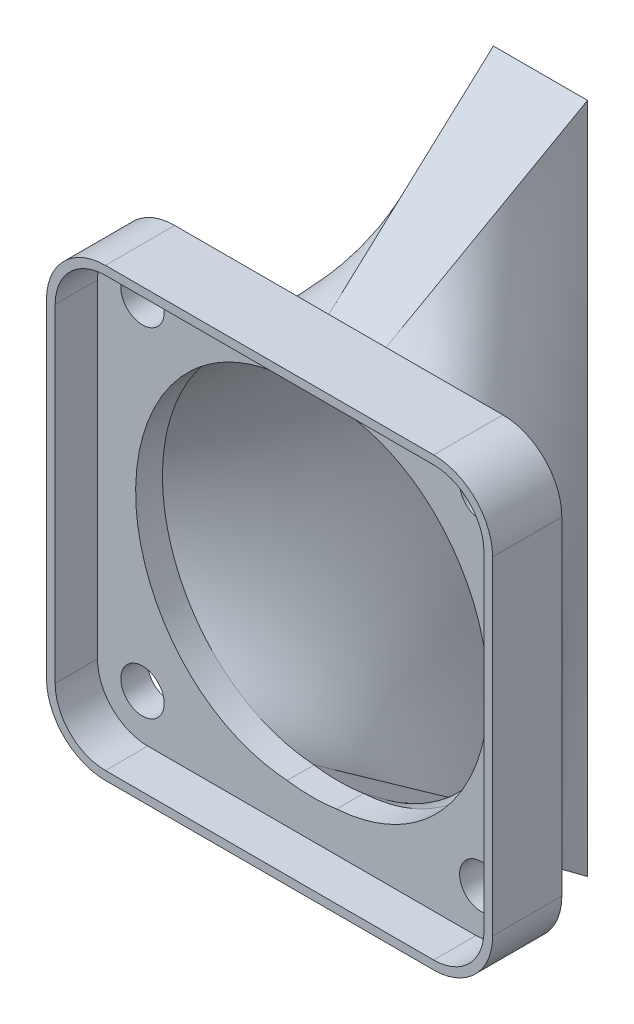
SolidWorks part; units mm, degrees
ref_plane "Front Plane" through (0, 0, 0) normal (0, 0, 1) x (1, 0, 0)
ref_plane "Top Plane" through (0, 0, 0) normal (0, 1, 0) x (1, 0, 0)
ref_plane "Right Plane" through (0, 0, 0) normal (1, 0, 0) x (0, 0, -1)
sketch "Sketch1" plane through (0, 0, 0) normal (0, 0, 1) x (1, 0, 0)
  line L8 (556.6783, -1295.6386) -> (566.1039, -1295.6386)
  line L9 (541.7911, -1271.3258) -> (541.7911, -1280.7514)
  line L10 (566.1039, -1256.4386) -> (556.6783, -1256.4386)
  line L11 (580.9911, -1280.7514) -> (580.9911, -1271.3258)
  line L18 (578.1165, -1263.5558) -> (577.608, -1264.0644)
  line L19 (580.1823, -1267.0666) -> (579.5228, -1267.2289)
  line L28 (581.1911, -1266.0843) -> (580.7911, -1266.0843)
  line L29 (580.7911, -1266.0843) -> (580.7911, -1266.2898)
  line L30 (578.1165, -1263.5558) -> (579.4254, -1262.247)
  line L31 (580.7911, -1262.8126) -> (580.7911, -1263.493)
  line L32 (580.7911, -1263.493) -> (581.1911, -1263.493)
  line L33 (581.1911, -1263.493) -> (581.1911, -1260.5386)
  line L34 (576.8911, -1256.2386) -> (545.8911, -1256.2386)
  line L35 (541.5911, -1260.5386) -> (541.5911, -1291.5386)
  line L36 (545.8911, -1295.8386) -> (576.8911, -1295.8386)
  line L37 (581.1911, -1291.5386) -> (581.1911, -1266.0843)
  arc A4 (547.4411, -1260.0386) -> (543.3411, -1260.0386) centre (545.3911, -1260.0386) ccw
  arc A5 (543.3411, -1260.0386) -> (547.4411, -1260.0386) centre (545.3911, -1260.0386) ccw
  arc A8 (579.4411, -1292.0386) -> (575.3411, -1292.0386) centre (577.3911, -1292.0386) ccw
  arc A9 (575.3411, -1292.0386) -> (579.4411, -1292.0386) centre (577.3911, -1292.0386) ccw
  arc A12 (547.4411, -1292.0386) -> (543.3411, -1292.0386) centre (545.3911, -1292.0386) ccw
  arc A13 (543.3411, -1292.0386) -> (547.4411, -1292.0386) centre (545.3911, -1292.0386) ccw
  arc A28 (579.4411, -1260.0386) -> (575.3411, -1260.0386) centre (577.3911, -1260.0386) ccw
  arc A29 (575.3411, -1260.0386) -> (579.4411, -1260.0386) centre (577.3911, -1260.0386) ccw
  arc A36 (576.8802, -1288.9405) -> (580.9911, -1280.7514) centre (561.3911, -1276.0386) ccw
  arc A37 (576.8802, -1288.9405) -> (574.2929, -1291.5278) centre (577.3911, -1292.0386) ccw
  arc A38 (566.1039, -1295.6386) -> (574.2929, -1291.5278) centre (561.3911, -1276.0386) ccw
  arc A39 (548.4892, -1291.5278) -> (556.6783, -1295.6386) centre (561.3911, -1276.0386) ccw
  arc A40 (548.4892, -1291.5278) -> (545.902, -1288.9405) centre (545.3911, -1292.0386) ccw
  arc A41 (541.7911, -1280.7514) -> (545.902, -1288.9405) centre (561.3911, -1276.0386) ccw
  arc A42 (545.902, -1263.1368) -> (541.7911, -1271.3258) centre (561.3911, -1276.0386) ccw
  arc A43 (545.902, -1263.1368) -> (548.4892, -1260.5495) centre (545.3911, -1260.0386) ccw
  arc A44 (556.6783, -1256.4386) -> (548.4892, -1260.5495) centre (561.3911, -1276.0386) ccw
  arc A45 (574.2929, -1260.5495) -> (566.1039, -1256.4386) centre (561.3911, -1276.0386) ccw
  arc A46 (574.2929, -1260.5495) -> (576.8802, -1263.1368) centre (577.3911, -1260.0386) ccw
  arc A47 (580.9911, -1271.3258) -> (579.5228, -1267.2289) centre (561.3911, -1276.0386) ccw
  arc A49 (577.608, -1264.0644) -> (576.8802, -1263.1368) centre (561.3911, -1276.0386) ccw
  arc A58 (580.1823, -1267.0666) -> (580.7911, -1266.2898) centre (579.9911, -1266.2898) ccw
  arc A62 (580.7911, -1262.8126) -> (579.4254, -1262.247) centre (579.9911, -1262.8126) ccw
  arc A63 (581.1911, -1260.5386) -> (576.8911, -1256.2386) centre (576.8911, -1260.5386) ccw
  arc A64 (545.8911, -1256.2386) -> (541.5911, -1260.5386) centre (545.8911, -1260.5386) ccw
  arc A65 (541.5911, -1291.5386) -> (545.8911, -1295.8386) centre (545.8911, -1291.5386) ccw
  arc A66 (576.8911, -1295.8386) -> (581.1911, -1291.5386) centre (576.8911, -1291.5386) ccw
extrude "Boss-Extrude1" add sketch "Sketch1" along normal blind 2.54
sketch "Sketch2" plane through (0, 0, 2.54) normal (0, 0, 1) x (1, 0, 0)
  line L0 (582.4611, -1291.5386) -> (582.4611, -1264.8143)
  line L1 (582.4611, -1264.8143) -> (579.5211, -1264.8143)
  line L2 (579.5211, -1264.8143) -> (579.5211, -1265.9215)
  line L3 (579.5211, -1265.9215) -> (577.628, -1266.3875)
  line L4 (579.7211, -1271.4788) -> (579.7211, -1280.5984)
  line L5 (565.9509, -1294.3686) -> (556.8313, -1294.3686)
  line L6 (543.0611, -1280.5984) -> (543.0611, -1271.4788)
  line L7 (556.8313, -1257.7086) -> (565.9509, -1257.7086)
  line L8 (577.421, -1266.0474) -> (579.5211, -1263.9473)
  line L9 (579.5211, -1263.9473) -> (579.5211, -1264.763)
  line L10 (579.5211, -1264.763) -> (582.4611, -1264.763)
  line L11 (582.4611, -1264.763) -> (582.4611, -1260.5386)
  line L12 (576.8911, -1254.9686) -> (545.8911, -1254.9686)
  line L13 (540.3211, -1260.5386) -> (540.3211, -1291.5386)
  line L14 (545.8911, -1297.1086) -> (576.8911, -1297.1086)
  line L15 (581.1911, -1291.5386) -> (581.1911, -1266.0843)
  line L16 (581.1911, -1266.0843) -> (580.7911, -1266.0843)
  line L17 (580.7911, -1266.0843) -> (580.7911, -1266.2898)
  line L18 (580.1823, -1267.0666) -> (579.5228, -1267.2289)
  line L19 (580.9911, -1271.3258) -> (580.9911, -1280.7514)
  line L20 (566.1039, -1295.6386) -> (556.6783, -1295.6386)
  line L21 (541.7911, -1280.7514) -> (541.7911, -1271.3258)
  line L22 (556.6783, -1256.4386) -> (566.1039, -1256.4386)
  line L23 (577.608, -1264.0644) -> (579.4254, -1262.247)
  line L24 (580.7911, -1262.8126) -> (580.7911, -1263.493)
  line L25 (580.7911, -1263.493) -> (581.1911, -1263.493)
  line L26 (581.1911, -1263.493) -> (581.1911, -1260.5386)
  line L27 (576.8911, -1256.2386) -> (545.8911, -1256.2386)
  line L28 (541.5911, -1260.5386) -> (541.5911, -1291.5386)
  line L29 (545.8911, -1295.8386) -> (576.8911, -1295.8386)
  line L30 (581.1911, -1291.5386) -> (581.1911, -1266.0843)
  line L31 (581.1911, -1266.0843) -> (580.7911, -1266.0843)
  line L32 (580.7911, -1266.0843) -> (580.7911, -1266.2898)
  line L33 (580.1823, -1267.0666) -> (579.5228, -1267.2289)
  line L34 (580.9911, -1271.3258) -> (580.9911, -1280.7514)
  line L35 (566.1039, -1295.6386) -> (556.6783, -1295.6386)
  line L36 (541.7911, -1280.7514) -> (541.7911, -1271.3258)
  line L37 (556.6783, -1256.4386) -> (566.1039, -1256.4386)
  line L38 (577.608, -1264.0644) -> (579.4254, -1262.247)
  line L39 (580.7911, -1262.8126) -> (580.7911, -1263.493)
  line L40 (580.7911, -1263.493) -> (581.1911, -1263.493)
  line L41 (581.1911, -1263.493) -> (581.1911, -1260.5386)
  line L42 (576.8911, -1256.2386) -> (545.8911, -1256.2386)
  line L43 (541.5911, -1260.5386) -> (541.5911, -1291.5386)
  line L44 (545.8911, -1295.8386) -> (576.8911, -1295.8386)
  line L45 (581.1911, -1266.0843) -> (582.4611, -1266.0843)
  line L46 (581.1911, -1263.493) -> (582.4611, -1263.493)
  arc A0 (579.5211, -1265.9215) -> (579.5211, -1265.9215) centre (579.5211, -1265.9215) ccw
  arc A1 (579.7211, -1271.4788) -> (577.628, -1266.3875) centre (561.3911, -1276.0386) ccw
  arc A2 (576.1704, -1287.8009) -> (579.7211, -1280.5984) centre (561.3911, -1276.0386) ccw
  arc A3 (576.1704, -1287.8009) -> (573.1534, -1290.818) centre (577.3911, -1292.0386) ccw
  arc A4 (565.9509, -1294.3686) -> (573.1534, -1290.818) centre (561.3911, -1276.0386) ccw
  arc A5 (549.6288, -1290.818) -> (556.8313, -1294.3686) centre (561.3911, -1276.0386) ccw
  arc A6 (549.6288, -1290.818) -> (546.6117, -1287.8009) centre (545.3911, -1292.0386) ccw
  arc A7 (543.0611, -1280.5984) -> (546.6117, -1287.8009) centre (561.3911, -1276.0386) ccw
  arc A8 (546.6117, -1264.2763) -> (543.0611, -1271.4788) centre (561.3911, -1276.0386) ccw
  arc A9 (546.6117, -1264.2763) -> (549.6288, -1261.2593) centre (545.3911, -1260.0386) ccw
  arc A10 (556.8313, -1257.7086) -> (549.6288, -1261.2593) centre (561.3911, -1276.0386) ccw
  arc A11 (573.1534, -1261.2593) -> (565.9509, -1257.7086) centre (561.3911, -1276.0386) ccw
  arc A12 (573.1534, -1261.2593) -> (576.1704, -1264.2763) centre (577.3911, -1260.0386) ccw
  arc A13 (577.421, -1266.0474) -> (576.1704, -1264.2763) centre (561.3911, -1276.0386) ccw
  arc A14 (579.5211, -1263.9473) -> (579.5211, -1263.9473) centre (579.5211, -1263.9473) ccw
  arc A15 (582.4611, -1260.5386) -> (576.8911, -1254.9686) centre (576.8911, -1260.5386) ccw
  arc A16 (545.8911, -1254.9686) -> (540.3211, -1260.5386) centre (545.8911, -1260.5386) ccw
  arc A17 (540.3211, -1291.5386) -> (545.8911, -1297.1086) centre (545.8911, -1291.5386) ccw
  arc A18 (576.8911, -1297.1086) -> (582.4611, -1291.5386) centre (576.8911, -1291.5386) ccw
  arc A19 (580.1823, -1267.0666) -> (580.7911, -1266.2898) centre (579.9911, -1266.2898) ccw
  arc A20 (580.9911, -1271.3258) -> (579.5228, -1267.2289) centre (561.3911, -1276.0386) ccw
  arc A21 (576.8802, -1288.9405) -> (580.9911, -1280.7514) centre (561.3911, -1276.0386) ccw
  arc A22 (576.8802, -1288.9405) -> (574.2929, -1291.5278) centre (577.3911, -1292.0386) ccw
  arc A23 (566.1039, -1295.6386) -> (574.2929, -1291.5278) centre (561.3911, -1276.0386) ccw
  arc A24 (548.4892, -1291.5278) -> (556.6783, -1295.6386) centre (561.3911, -1276.0386) ccw
  arc A25 (548.4892, -1291.5278) -> (545.902, -1288.9405) centre (545.3911, -1292.0386) ccw
  arc A26 (541.7911, -1280.7514) -> (545.902, -1288.9405) centre (561.3911, -1276.0386) ccw
  arc A27 (545.902, -1263.1368) -> (541.7911, -1271.3258) centre (561.3911, -1276.0386) ccw
  arc A28 (545.902, -1263.1368) -> (548.4892, -1260.5495) centre (545.3911, -1260.0386) ccw
  arc A29 (556.6783, -1256.4386) -> (548.4892, -1260.5495) centre (561.3911, -1276.0386) ccw
  arc A30 (574.2929, -1260.5495) -> (566.1039, -1256.4386) centre (561.3911, -1276.0386) ccw
  arc A31 (574.2929, -1260.5495) -> (576.8802, -1263.1368) centre (577.3911, -1260.0386) ccw
  arc A32 (577.608, -1264.0644) -> (576.8802, -1263.1368) centre (561.3911, -1276.0386) ccw
  arc A33 (580.7911, -1262.8126) -> (579.4254, -1262.247) centre (579.9911, -1262.8126) ccw
  arc A34 (581.1911, -1260.5386) -> (576.8911, -1256.2386) centre (576.8911, -1260.5386) ccw
  arc A35 (545.8911, -1256.2386) -> (541.5911, -1260.5386) centre (545.8911, -1260.5386) ccw
  arc A36 (541.5911, -1291.5386) -> (545.8911, -1295.8386) centre (545.8911, -1291.5386) ccw
  arc A37 (576.8911, -1295.8386) -> (581.1911, -1291.5386) centre (576.8911, -1291.5386) ccw
  arc A38 (580.1823, -1267.0666) -> (580.7911, -1266.2898) centre (579.9911, -1266.2898) ccw
  arc A39 (580.9911, -1271.3258) -> (579.5228, -1267.2289) centre (561.3911, -1276.0386) ccw
  arc A40 (576.8802, -1288.9405) -> (580.9911, -1280.7514) centre (561.3911, -1276.0386) ccw
  arc A41 (576.8802, -1288.9405) -> (574.2929, -1291.5278) centre (577.3911, -1292.0386) ccw
  arc A42 (566.1039, -1295.6386) -> (574.2929, -1291.5278) centre (561.3911, -1276.0386) ccw
  arc A43 (548.4892, -1291.5278) -> (556.6783, -1295.6386) centre (561.3911, -1276.0386) ccw
  arc A44 (548.4892, -1291.5278) -> (545.902, -1288.9405) centre (545.3911, -1292.0386) ccw
  arc A45 (541.7911, -1280.7514) -> (545.902, -1288.9405) centre (561.3911, -1276.0386) ccw
  arc A46 (545.902, -1263.1368) -> (541.7911, -1271.3258) centre (561.3911, -1276.0386) ccw
  arc A47 (545.902, -1263.1368) -> (548.4892, -1260.5495) centre (545.3911, -1260.0386) ccw
  arc A48 (556.6783, -1256.4386) -> (548.4892, -1260.5495) centre (561.3911, -1276.0386) ccw
  arc A49 (574.2929, -1260.5495) -> (566.1039, -1256.4386) centre (561.3911, -1276.0386) ccw
  arc A50 (574.2929, -1260.5495) -> (576.8802, -1263.1368) centre (577.3911, -1260.0386) ccw
  arc A51 (577.608, -1264.0644) -> (576.8802, -1263.1368) centre (561.3911, -1276.0386) ccw
  arc A52 (580.7911, -1262.8126) -> (579.4254, -1262.247) centre (579.9911, -1262.8126) ccw
  arc A53 (581.1911, -1260.5386) -> (576.8911, -1256.2386) centre (576.8911, -1260.5386) ccw
  arc A54 (545.8911, -1256.2386) -> (541.5911, -1260.5386) centre (545.8911, -1260.5386) ccw
  arc A55 (541.5911, -1291.5386) -> (545.8911, -1295.8386) centre (545.8911, -1291.5386) ccw
  arc A56 (576.8911, -1295.8386) -> (581.1911, -1291.5386) centre (576.8911, -1291.5386) ccw
  dimension "D1" = 0
  dimension "D2" = 1.27
extrude "Boss-Extrude2" add sketch "Sketch2" against normal up to vertex contours L14 A18 L0 L45 L46 L11 A15 L12 A16 L13 A17 M37 M70 M69 M68 M67 M66 M65 M64 M63
sketch "Sketch3" plane through (0, 0, 2.54) normal (0, 0, 1) x (1, 0, 0)
  line L0 (576.8911, -1291.5386) -> (574.2727, -1288.9203)
  line L15 (582.4611, -1291.5386) -> (582.4611, -1266.0843)
  line L16 (582.4611, -1266.0843) -> (580.7911, -1266.0843)
  line L17 (580.7911, -1266.0843) -> (580.7911, -1266.2898)
  line L18 (580.1823, -1267.0666) -> (579.5228, -1267.2289)
  line L19 (580.9911, -1271.3258) -> (580.9911, -1280.7514)
  line L20 (566.1039, -1295.6386) -> (556.6783, -1295.6386)
  line L21 (541.7911, -1280.7514) -> (541.7911, -1271.3258)
  line L22 (556.6783, -1256.4386) -> (566.1039, -1256.4386)
  line L23 (577.608, -1264.0644) -> (579.4254, -1262.247)
  line L24 (580.7911, -1262.8126) -> (580.7911, -1263.493)
  line L25 (580.7911, -1263.493) -> (582.4611, -1263.493)
  line L26 (582.4611, -1263.493) -> (582.4611, -1260.5386)
  line L27 (576.8911, -1254.9686) -> (545.8911, -1254.9686)
  line L28 (540.3211, -1260.5386) -> (540.3211, -1291.5386)
  line L29 (545.8911, -1297.1086) -> (576.8911, -1297.1086)
  line L30 (582.4611, -1291.5386) -> (582.4611, -1266.0843)
  line L31 (582.4611, -1266.0843) -> (580.7911, -1266.0843)
  line L32 (580.7911, -1266.0843) -> (580.7911, -1266.2898)
  line L33 (580.1823, -1267.0666) -> (579.5228, -1267.2289)
  line L34 (580.9911, -1271.3258) -> (580.9911, -1280.7514)
  line L35 (566.1039, -1295.6386) -> (556.6783, -1295.6386)
  line L36 (541.7911, -1280.7514) -> (541.7911, -1271.3258)
  line L37 (556.6783, -1256.4386) -> (566.1039, -1256.4386)
  line L38 (577.608, -1264.0644) -> (579.4254, -1262.247)
  line L39 (580.7911, -1262.8126) -> (580.7911, -1263.493)
  line L40 (580.7911, -1263.493) -> (582.4611, -1263.493)
  line L41 (582.4611, -1263.493) -> (582.4611, -1260.5386)
  line L42 (576.8911, -1254.9686) -> (545.8911, -1254.9686)
  line L43 (540.3211, -1260.5386) -> (540.3211, -1291.5386)
  line L44 (545.8911, -1297.1086) -> (576.8911, -1297.1086)
  arc A0 (574.2929, -1260.5495) -> (576.8802, -1263.1368) centre (577.3911, -1260.0386) ccw construction
  circle A1 centre (545.3911, -1260.0386) radius 2.05
  circle A2 centre (545.3911, -1260.0386) radius 2.05
  circle A3 centre (577.3911, -1292.0386) radius 2.05
  circle A4 centre (577.3911, -1292.0386) radius 2.05
  circle A5 centre (545.3911, -1292.0386) radius 2.05
  circle A6 centre (545.3911, -1292.0386) radius 2.05
  circle A7 centre (577.3911, -1260.0386) radius 2.05
  circle A8 centre (577.3911, -1260.0386) radius 2.05
  arc A9 (545.902, -1263.1368) -> (548.4892, -1260.5495) centre (545.3911, -1260.0386) ccw construction
  arc A10 (548.4892, -1291.5278) -> (545.902, -1288.9405) centre (545.3911, -1292.0386) ccw construction
  arc A11 (576.8802, -1288.9405) -> (574.2929, -1291.5278) centre (577.3911, -1292.0386) ccw construction
  arc A12 (574.2929, -1260.5495) -> (576.8802, -1263.1368) centre (577.3911, -1260.0386) ccw
  arc A13 (545.902, -1263.1368) -> (548.4892, -1260.5495) centre (545.3911, -1260.0386) ccw
  arc A14 (548.4892, -1291.5278) -> (545.902, -1288.9405) centre (545.3911, -1292.0386) ccw
  arc A15 (576.8802, -1288.9405) -> (574.2929, -1291.5278) centre (577.3911, -1292.0386) ccw
  arc A16 (576.6736, -1287.6874) -> (573.0398, -1291.3211) centre (577.3911, -1292.0386) ccw construction
  arc A17 (549.7423, -1291.3211) -> (546.1086, -1287.6874) centre (545.3911, -1292.0386) ccw construction
  arc A18 (546.1086, -1264.3899) -> (549.7423, -1260.7561) centre (545.3911, -1260.0386) ccw construction
  arc A19 (573.0398, -1260.7561) -> (576.6736, -1264.3899) centre (577.3911, -1260.0386) ccw construction
  circle A20 centre (561.3911, -1276.0386) radius 18.2174
  arc A22 (580.9911, -1271.3258) -> (576.8802, -1263.1368) centre (561.3911, -1276.0386) ccw
  arc A39 (580.1823, -1267.0666) -> (580.7911, -1266.2898) centre (579.9911, -1266.2898) ccw
  arc A40 (580.9911, -1271.3258) -> (579.5228, -1267.2289) centre (561.3911, -1276.0386) ccw
  arc A41 (576.8802, -1288.9405) -> (580.9911, -1280.7514) centre (561.3911, -1276.0386) ccw
  arc A42 (576.8802, -1288.9405) -> (574.2929, -1291.5278) centre (577.3911, -1292.0386) ccw
  arc A43 (566.1039, -1295.6386) -> (574.2929, -1291.5278) centre (561.3911, -1276.0386) ccw
  arc A44 (548.4892, -1291.5278) -> (556.6783, -1295.6386) centre (561.3911, -1276.0386) ccw
  arc A45 (548.4892, -1291.5278) -> (545.902, -1288.9405) centre (545.3911, -1292.0386) ccw
  arc A46 (541.7911, -1280.7514) -> (545.902, -1288.9405) centre (561.3911, -1276.0386) ccw
  arc A47 (545.902, -1263.1368) -> (541.7911, -1271.3258) centre (561.3911, -1276.0386) ccw
  arc A48 (545.902, -1263.1368) -> (548.4892, -1260.5495) centre (545.3911, -1260.0386) ccw
  arc A49 (556.6783, -1256.4386) -> (548.4892, -1260.5495) centre (561.3911, -1276.0386) ccw
  arc A50 (574.2929, -1260.5495) -> (566.1039, -1256.4386) centre (561.3911, -1276.0386) ccw
  arc A51 (574.2929, -1260.5495) -> (576.8802, -1263.1368) centre (577.3911, -1260.0386) ccw
  arc A52 (577.608, -1264.0644) -> (576.8802, -1263.1368) centre (561.3911, -1276.0386) ccw
  arc A53 (580.7911, -1262.8126) -> (579.4254, -1262.247) centre (579.9911, -1262.8126) ccw
  arc A54 (582.4611, -1260.5386) -> (576.8911, -1254.9686) centre (576.8911, -1260.5386) ccw
  arc A55 (545.8911, -1254.9686) -> (540.3211, -1260.5386) centre (545.8911, -1260.5386) ccw
  arc A56 (540.3211, -1291.5386) -> (545.8911, -1297.1086) centre (545.8911, -1291.5386) ccw
  arc A57 (576.8911, -1297.1086) -> (582.4611, -1291.5386) centre (576.8911, -1291.5386) ccw
  arc A58 (580.1823, -1267.0666) -> (580.7911, -1266.2898) centre (579.9911, -1266.2898) ccw
  arc A59 (580.9911, -1271.3258) -> (579.5228, -1267.2289) centre (561.3911, -1276.0386) ccw
  arc A60 (576.8802, -1288.9405) -> (580.9911, -1280.7514) centre (561.3911, -1276.0386) ccw
  arc A61 (576.8802, -1288.9405) -> (574.2929, -1291.5278) centre (577.3911, -1292.0386) ccw
  arc A62 (566.1039, -1295.6386) -> (574.2929, -1291.5278) centre (561.3911, -1276.0386) ccw
  arc A63 (548.4892, -1291.5278) -> (556.6783, -1295.6386) centre (561.3911, -1276.0386) ccw
  arc A64 (548.4892, -1291.5278) -> (545.902, -1288.9405) centre (545.3911, -1292.0386) ccw
  arc A65 (541.7911, -1280.7514) -> (545.902, -1288.9405) centre (561.3911, -1276.0386) ccw
  arc A66 (545.902, -1263.1368) -> (541.7911, -1271.3258) centre (561.3911, -1276.0386) ccw
  arc A67 (545.902, -1263.1368) -> (548.4892, -1260.5495) centre (545.3911, -1260.0386) ccw
  arc A68 (556.6783, -1256.4386) -> (548.4892, -1260.5495) centre (561.3911, -1276.0386) ccw
  arc A69 (574.2929, -1260.5495) -> (566.1039, -1256.4386) centre (561.3911, -1276.0386) ccw
  arc A70 (574.2929, -1260.5495) -> (576.8802, -1263.1368) centre (577.3911, -1260.0386) ccw
  arc A71 (577.608, -1264.0644) -> (576.8802, -1263.1368) centre (561.3911, -1276.0386) ccw
  arc A72 (580.7911, -1262.8126) -> (579.4254, -1262.247) centre (579.9911, -1262.8126) ccw
  arc A73 (582.4611, -1260.5386) -> (576.8911, -1254.9686) centre (576.8911, -1260.5386) ccw
  arc A74 (545.8911, -1254.9686) -> (540.3211, -1260.5386) centre (545.8911, -1260.5386) ccw
  arc A75 (540.3211, -1291.5386) -> (545.8911, -1297.1086) centre (545.8911, -1291.5386) ccw
  arc A76 (576.8911, -1297.1086) -> (582.4611, -1291.5386) centre (576.8911, -1291.5386) ccw
  dimension "D1" = 0
  dimension "D2" = 0
  dimension "D3" = 0
  dimension "D4" = 0
  dimension "D5" = 1.27
  dimension "D6" = 0
extrude "Boss-Extrude3" add sketch "Sketch3" against normal up to vertex
ref_plane "Plane1" through (0, -1276.0386, 0) normal (0, -1, 0) x (-1, 0, 0)
ref_plane "Plane5" through (616.2022, 0, 0) normal (-1, 0, 0) x (0, 0, 1)
sketch "Sketch4" plane through (0, 0, 0) normal (0, 0, -1) x (-1, 0, 0)
  circle A0 centre (-561.3911, -1276.0386) radius 18.2174 construction
  circle A1 centre (-561.3911, -1276.0386) radius 18.2174
ref_plane "Plane6" through (0, 0, -72.9848) normal (0, 0, 1) x (1, 0, 0)
ref_plane "Plane7" through (0, 0, -19.05) normal (0, 0, -1) x (-1, 0, 0)
sketch "Sketch7" plane through (0, 0, -19.05) normal (0, 0, 1) x (1, 0, 0)
  line L1 (556.9461, -1244.2886) -> (565.8361, -1244.2886)
  line L2 (556.9461, -1244.2886) -> (556.9461, -1307.7886)
  line L3 (556.9461, -1307.7886) -> (565.8361, -1307.7886)
  line L4 (565.8361, -1244.2886) -> (565.8361, -1307.7886)
  line L5 (556.9461, -1244.2886) -> (565.8361, -1307.7886) construction
  line L6 (556.9461, -1307.7886) -> (565.8361, -1244.2886) construction
  circle A0 centre (561.3911, -1276.0386) radius 18.2174 construction
  circle A1 centre (561.3911, -1276.0386) radius 18.2174 construction
  dimension "D1" = 63.5
  dimension "D2" = 8.89
loft "Loft-Thin1" add profiles "Sketch7", "Sketch4" parameters "D1"=1.27
sketch "Sketch8" plane through (0, 0, 2.54) normal (0, 0, 1) x (1, 0, 0)
  line L3 (576.8911, -1256.0386) -> (545.8911, -1256.0386)
  line L4 (545.8911, -1296.0386) -> (576.8911, -1296.0386)
  line L5 (541.3911, -1260.5386) -> (541.3911, -1291.5386)
  line L10 (581.3911, -1263.493) -> (581.3911, -1260.5386)
  line L11 (582.4611, -1291.5386) -> (582.4611, -1266.0843)
  line L12 (582.4611, -1266.0843) -> (580.7911, -1266.0843)
  line L13 (580.7911, -1266.0843) -> (580.7911, -1266.2898)
  line L14 (580.1823, -1267.0666) -> (579.5228, -1267.2289)
  line L15 (577.608, -1264.0644) -> (579.4254, -1262.247)
  line L16 (580.7911, -1262.8126) -> (580.7911, -1263.493)
  line L17 (580.7911, -1263.493) -> (582.4611, -1263.493)
  line L18 (582.4611, -1263.493) -> (582.4611, -1260.5386)
  line L19 (576.8911, -1254.9686) -> (545.8911, -1254.9686)
  line L20 (540.3211, -1260.5386) -> (540.3211, -1291.5386)
  line L21 (545.8911, -1297.1086) -> (576.8911, -1297.1086)
  line L22 (582.4611, -1291.5386) -> (582.4611, -1266.0843)
  line L23 (582.4611, -1266.0843) -> (581.3911, -1266.0843)
  line L28 (581.3911, -1263.493) -> (582.4611, -1263.493)
  line L29 (582.4611, -1263.493) -> (582.4611, -1260.5386)
  line L30 (576.8911, -1254.9686) -> (545.8911, -1254.9686)
  line L31 (540.3211, -1260.5386) -> (540.3211, -1291.5386)
  line L32 (545.8911, -1297.1086) -> (576.8911, -1297.1086)
  line L33 (576.8911, -1255.7846) -> (545.8911, -1255.7846)
  line L34 (581.3911, -1271.2386) -> (581.3911, -1268.1386)
  line L35 (581.3911, -1291.5386) -> (581.3911, -1271.2386)
  line L36 (581.3911, -1268.1386) -> (581.3911, -1266.0843)
  line L37 (541.1371, -1260.5386) -> (541.1371, -1291.5386)
  line L38 (545.8911, -1296.2926) -> (576.8911, -1296.2926)
  line L39 (581.6451, -1291.5386) -> (581.6451, -1271.2386)
  line L40 (581.6451, -1271.2386) -> (581.6451, -1268.1386)
  line L41 (581.6451, -1268.1386) -> (581.6451, -1266.3383)
  line L43 (582.2071, -1291.5386) -> (582.2071, -1266.3383)
  line L44 (545.8911, -1296.8546) -> (576.8911, -1296.8546)
  line L45 (540.5751, -1260.5386) -> (540.5751, -1291.5386)
  line L46 (576.8911, -1255.2226) -> (545.8911, -1255.2226)
  line L47 (582.2071, -1263.239) -> (582.2071, -1260.5386)
  line L49 (581.6451, -1263.239) -> (581.6451, -1260.5386)
  line L50 (581.6451, -1263.239) -> (581.6451, -1263.493)
  line L51 (582.2071, -1263.239) -> (582.2071, -1263.493)
  line L52 (581.6451, -1266.3383) -> (581.6451, -1266.0843)
  line L53 (582.2071, -1266.3383) -> (582.2071, -1266.0843)
  line L61 (581.6451, -1263.239) -> (582.2071, -1263.239) construction
  line L62 (582.2071, -1266.3383) -> (581.6451, -1266.3383) construction
  arc A4 (581.3911, -1260.5386) -> (576.8911, -1256.0386) centre (576.8911, -1260.5386) ccw
  arc A5 (545.8911, -1256.0386) -> (541.3911, -1260.5386) centre (545.8911, -1260.5386) ccw
  arc A6 (576.8911, -1296.0386) -> (581.3911, -1291.5386) centre (576.8911, -1291.5386) ccw
  arc A7 (580.1823, -1267.0666) -> (580.7911, -1266.2898) centre (579.9911, -1266.2898) ccw
  arc A8 (579.5228, -1267.2289) -> (577.608, -1264.0644) centre (561.3911, -1276.0386) ccw
  arc A9 (580.7911, -1262.8126) -> (579.4254, -1262.247) centre (579.9911, -1262.8126) ccw
  arc A10 (582.4611, -1260.5386) -> (576.8911, -1254.9686) centre (576.8911, -1260.5386) ccw
  arc A11 (545.8911, -1254.9686) -> (540.3211, -1260.5386) centre (545.8911, -1260.5386) ccw
  arc A12 (540.3211, -1291.5386) -> (545.8911, -1297.1086) centre (545.8911, -1291.5386) ccw
  arc A13 (576.8911, -1297.1086) -> (582.4611, -1291.5386) centre (576.8911, -1291.5386) ccw
  arc A17 (582.4611, -1260.5386) -> (576.8911, -1254.9686) centre (576.8911, -1260.5386) ccw
  arc A18 (545.8911, -1254.9686) -> (540.3211, -1260.5386) centre (545.8911, -1260.5386) ccw
  arc A19 (540.3211, -1291.5386) -> (545.8911, -1297.1086) centre (545.8911, -1291.5386) ccw
  arc A20 (576.8911, -1297.1086) -> (582.4611, -1291.5386) centre (576.8911, -1291.5386) ccw
  arc A21 (541.3911, -1291.5386) -> (545.8911, -1296.0386) centre (545.8911, -1291.5386) ccw
  arc A22 (581.6451, -1260.5386) -> (576.8911, -1255.7846) centre (576.8911, -1260.5386) ccw
  arc A23 (545.8911, -1255.7846) -> (541.1371, -1260.5386) centre (545.8911, -1260.5386) ccw
  arc A24 (541.1371, -1291.5386) -> (545.8911, -1296.2926) centre (545.8911, -1291.5386) ccw
  arc A25 (576.8911, -1296.2926) -> (581.6451, -1291.5386) centre (576.8911, -1291.5386) ccw
  arc A26 (576.8911, -1296.8546) -> (582.2071, -1291.5386) centre (576.8911, -1291.5386) ccw
  arc A27 (540.5751, -1291.5386) -> (545.8911, -1296.8546) centre (545.8911, -1291.5386) ccw
  arc A28 (545.8911, -1255.2226) -> (540.5751, -1260.5386) centre (545.8911, -1260.5386) ccw
  arc A29 (582.2071, -1260.5386) -> (576.8911, -1255.2226) centre (576.8911, -1260.5386) ccw
  dimension "D1" = 0
  dimension "D2" = 0.254
extrude "Boss-Extrude5" add sketch "Sketch8" along normal up to vertex contours L47 A29 L46 A28 L45 A27 L44 A26 L43 L53 L23 L52 L41 L40 L39 A25 L38 A24 L37 A23 L33 A22 L49 L50 L28 L51 | A29 L47 L51 L53 L43 A26 L44 A27 L45 A28 L46 M28 M29 M30 M31 M32 M33 M34 M35 M36 M19 M20
sketch "Sketch9" plane through (0, 0, 0) normal (0, 0, -1) x (-1, 0, 0)
  line L0 (-582.4611, -1266.0843) -> (-582.4611, -1263.493)
  line L11 (-580.7911, -1266.0843) -> (-582.4611, -1266.0843)
  line L12 (-582.4611, -1266.0843) -> (-582.4611, -1291.5386)
  line L13 (-576.8911, -1297.1086) -> (-545.8911, -1297.1086)
  line L14 (-540.3211, -1291.5386) -> (-540.3211, -1260.5386)
  line L15 (-545.8911, -1254.9686) -> (-576.8911, -1254.9686)
  line L16 (-582.4611, -1260.5386) -> (-582.4611, -1263.493)
  line L17 (-582.4611, -1263.493) -> (-580.7911, -1263.493)
  line L18 (-580.7911, -1263.493) -> (-580.7911, -1262.8126)
  line L19 (-579.4254, -1262.247) -> (-577.608, -1264.0644)
  line L20 (-579.5228, -1267.2289) -> (-580.1823, -1267.0666)
  line L21 (-580.7911, -1266.2898) -> (-580.7911, -1266.0843)
  line L22 (-580.7911, -1266.0843) -> (-582.4611, -1266.0843)
  line L23 (-582.4611, -1266.0843) -> (-582.4611, -1291.5386)
  line L24 (-576.8911, -1297.1086) -> (-545.8911, -1297.1086)
  line L25 (-540.3211, -1291.5386) -> (-540.3211, -1260.5386)
  line L26 (-545.8911, -1254.9686) -> (-576.8911, -1254.9686)
  line L27 (-582.4611, -1260.5386) -> (-582.4611, -1263.493)
  line L28 (-582.4611, -1263.493) -> (-580.7911, -1263.493)
  line L29 (-580.7911, -1263.493) -> (-580.7911, -1262.8126)
  line L30 (-579.4254, -1262.247) -> (-577.608, -1264.0644)
  line L31 (-579.5228, -1267.2289) -> (-580.1823, -1267.0666)
  line L32 (-580.7911, -1266.2898) -> (-580.7911, -1266.0843)
  arc A7 (-582.4611, -1291.5386) -> (-576.8911, -1297.1086) centre (-576.8911, -1291.5386) ccw
  arc A8 (-545.8911, -1297.1086) -> (-540.3211, -1291.5386) centre (-545.8911, -1291.5386) ccw
  arc A9 (-540.3211, -1260.5386) -> (-545.8911, -1254.9686) centre (-545.8911, -1260.5386) ccw
  arc A10 (-576.8911, -1254.9686) -> (-582.4611, -1260.5386) centre (-576.8911, -1260.5386) ccw
  arc A11 (-579.4254, -1262.247) -> (-580.7911, -1262.8126) centre (-579.9911, -1262.8126) ccw
  arc A12 (-577.608, -1264.0644) -> (-579.5228, -1267.2289) centre (-561.3911, -1276.0386) ccw
  arc A13 (-580.7911, -1266.2898) -> (-580.1823, -1267.0666) centre (-579.9911, -1266.2898) ccw
  arc A14 (-582.4611, -1291.5386) -> (-576.8911, -1297.1086) centre (-576.8911, -1291.5386) ccw
  arc A15 (-545.8911, -1297.1086) -> (-540.3211, -1291.5386) centre (-545.8911, -1291.5386) ccw
  arc A16 (-540.3211, -1260.5386) -> (-545.8911, -1254.9686) centre (-545.8911, -1260.5386) ccw
  arc A17 (-576.8911, -1254.9686) -> (-582.4611, -1260.5386) centre (-576.8911, -1260.5386) ccw
  arc A18 (-579.4254, -1262.247) -> (-580.7911, -1262.8126) centre (-579.9911, -1262.8126) ccw
  arc A19 (-577.608, -1264.0644) -> (-579.5228, -1267.2289) centre (-561.3911, -1276.0386) ccw
  arc A20 (-580.7911, -1266.2898) -> (-580.1823, -1267.0666) centre (-579.9911, -1266.2898) ccw
  dimension "D1" = 0
extrude "Boss-Extrude6" add sketch "Sketch9" against normal up to surface (2.54 mm away) contours L0 M20 M37 M36 M35 M34 M33 M32 M31 M30
sketch "Sketch10" plane through (0, 0, 6.54) normal (0, 0, 1) x (1, 0, 0)
  line L0 (582.4611, -1266.0843) -> (581.6451, -1266.0843) construction
  line L1 (581.6451, -1263.493) -> (582.4611, -1263.493) construction
  line L2 (582.4611, -1266.0843) -> (581.6451, -1266.0843)
  line L3 (581.6451, -1263.493) -> (582.4611, -1263.493)
  line L4 (582.4611, -1266.0843) -> (582.4611, -1263.493)
  line L5 (581.6451, -1263.493) -> (581.6451, -1266.0843)
extrude "Boss-Extrude7" add sketch "Sketch10" against normal up to surface (4 mm away)
sketch "Sketch11" plane through (0, 0, 0) normal (0, 0, 1) x (1, 0, 0)
  arc A4 (563.9169, -1294.0801) -> (563.9169, -1257.9972) centre (561.3911, -1276.0386) ccw
  arc A5 (563.9169, -1257.9972) -> (558.8653, -1257.9972) centre (561.3911, -1276.0386) ccw
  arc A6 (558.8653, -1257.9972) -> (558.8653, -1294.0801) centre (561.3911, -1276.0386) ccw
  arc A7 (558.8653, -1294.0801) -> (563.9169, -1294.0801) centre (561.3911, -1276.0386) ccw
  arc A8 (563.9169, -1294.0801) -> (563.9169, -1257.9972) centre (561.3911, -1276.0386) ccw
  arc A9 (563.9169, -1257.9972) -> (558.8653, -1257.9972) centre (561.3911, -1276.0386) ccw
  arc A10 (558.8653, -1257.9972) -> (558.8653, -1294.0801) centre (561.3911, -1276.0386) ccw
  arc A11 (558.8653, -1294.0801) -> (563.9169, -1294.0801) centre (561.3911, -1276.0386) ccw
  spline S0 degree 3 poles (522.2429, -260.2345) (461.0198, -1673.3131) (496.371, -1259.3864) (605.1667, -1259.3755) (645.1836, -1447.9795) (-416.4953, -1061.8152) knots -41.031834 -41.031834 -41.031834 -41.031834 0.5 0.5 28.463522 28.463522 28.463522 28.463522 only from (559.0543, -1259.5562) to (563.7279, -1259.5562) construction
  spline S1 degree 3 poles (601.8299, -260.2841) (319.6134, -1693.7103) (500.9513, -1241.7927) (567.1631, -1260.1969) (567.6374, -1260.3552) (568.5734, -1260.7233) (569.0358, -1260.9338) (570.3704, -1261.6284) (571.2019, -1262.1787) (572.366, -1263.129) (572.7419, -1263.4685) (573.4556, -1264.1797) (573.7931, -1264.5504) (574.7505, -1265.7049) (575.3156, -1266.5313) (576.3036, -1268.2943) (576.7131, -1269.2077) (577.208, -1270.6209) (577.3531, -1271.0992) (577.6034, -1272.0707) (577.7087, -1272.5661) (577.9592, -1274.0538) (578.0417, -1275.0483) (578.0412, -1276.5441) (578.02, -1277.0434) (577.9356, -1278.0433) (577.872, -1278.5461) (577.6196, -1280.0317) (577.3696, -1280.9966) (576.8749, -1282.4065) (576.69, -1282.8703) (576.2778, -1283.7845) (576.0494, -1284.2372) (575.3116, -1285.5516) (574.7492, -1286.3736) (573.7965, -1287.5229) (573.4608, -1287.892) (572.7506, -1288.6005) (572.3738, -1288.9415) (571.2069, -1289.8952) (570.3768, -1290.4445) (569.0518, -1291.1356) (568.5967, -1291.3439) (567.659, -1291.7144) (567.1781, -1291.8757) (507.9023, -1308.4048) (368.3935, -945.3429) (592.5896, -2292.087) knots -4.213232 -4.213232 -4.213232 -4.213232 0.0625 0.0625 0.09375 0.09375 0.125 0.125 0.1875 0.1875 0.21875 0.21875 0.25 0.25 0.3125 0.3125 0.375 0.375 0.40625 0.40625 0.4375 0.4375 0.5 0.5 0.53125 0.53125 0.5625 0.5625 0.625 0.625 0.65625 0.65625 0.6875 0.6875 0.75 0.75 0.78125 0.78125 0.8125 0.8125 0.875 0.875 0.90625 0.90625 0.9375 0.9375 4.73507 4.73507 4.73507 4.73507 only from (563.7279, -1259.5562) to (563.7279, -1292.521) construction
  spline S2 degree 3 poles (600.5393, -2291.8427) (661.7624, -878.7642) (626.4112, -1292.6908) (517.6154, -1292.7017) (477.5985, -1104.0977) (1539.2774, -1490.262) knots -41.031834 -41.031834 -41.031834 -41.031834 0.5 0.5 28.463522 28.463522 28.463522 28.463522 only from (563.7279, -1292.521) to (559.0543, -1292.521) construction
  spline S3 degree 3 poles (520.9523, -2291.7932) (803.1687, -858.3669) (621.8309, -1310.2846) (555.6191, -1291.8803) (555.1448, -1291.722) (554.2088, -1291.354) (553.7464, -1291.1434) (552.4117, -1290.4489) (551.5802, -1289.8985) (550.4162, -1288.9483) (550.0403, -1288.6088) (549.3265, -1287.8976) (548.9891, -1287.5269) (548.0317, -1286.3723) (547.4665, -1285.5459) (546.4786, -1283.7829) (546.0691, -1282.8696) (545.5742, -1281.4564) (545.429, -1280.978) (545.1787, -1280.0066) (545.0734, -1279.5112) (544.8229, -1278.0235) (544.7404, -1277.029) (544.741, -1275.5332) (544.7622, -1275.0339) (544.8465, -1274.034) (544.9102, -1273.5312) (545.1626, -1272.0456) (545.4126, -1271.0807) (545.9072, -1269.6707) (546.0922, -1269.207) (546.5043, -1268.2928) (546.7327, -1267.84) (547.4705, -1266.5257) (548.033, -1265.7037) (548.9856, -1264.5544) (549.3214, -1264.1853) (550.0315, -1263.4768) (550.4084, -1263.1357) (551.5753, -1262.182) (552.4054, -1261.6328) (553.7304, -1260.9416) (554.1855, -1260.7334) (555.1232, -1260.3628) (555.6041, -1260.2015) (614.8799, -1243.6725) (754.3887, -1606.7344) (530.1925, -259.9903) knots -4.213232 -4.213232 -4.213232 -4.213232 0.0625 0.0625 0.09375 0.09375 0.125 0.125 0.1875 0.1875 0.21875 0.21875 0.25 0.25 0.3125 0.3125 0.375 0.375 0.40625 0.40625 0.4375 0.4375 0.5 0.5 0.53125 0.53125 0.5625 0.5625 0.625 0.625 0.65625 0.65625 0.6875 0.6875 0.75 0.75 0.78125 0.78125 0.8125 0.8125 0.875 0.875 0.90625 0.90625 0.9375 0.9375 4.73507 4.73507 4.73507 4.73507 only from (559.0543, -1292.521) to (559.0543, -1259.5562) construction
  spline S4 degree 3 poles (559.0543, -1259.5562) (559.8283, -1259.4401) (560.6068, -1259.38) (562.1723, -1259.3798) (562.9538, -1259.4401) (563.7279, -1259.5562) knots 0 0 0 0 0.5 0.5 1 1 1 1
  spline S5 degree 3 poles (563.7279, -1259.5562) (564.7363, -1259.6297) (565.7218, -1259.7963) (567.1631, -1260.1969) (567.6374, -1260.3552) (568.5734, -1260.7233) (569.0358, -1260.9338) (570.3704, -1261.6284) (571.2019, -1262.1787) (572.366, -1263.129) (572.7419, -1263.4685) (573.4556, -1264.1797) (573.7931, -1264.5504) (574.7505, -1265.7049) (575.3156, -1266.5313) (576.3036, -1268.2943) (576.7131, -1269.2077) (577.208, -1270.6209) (577.3531, -1271.0992) (577.6034, -1272.0707) (577.7087, -1272.5661) (577.9592, -1274.0538) (578.0417, -1275.0483) (578.0412, -1276.5441) (578.02, -1277.0434) (577.9356, -1278.0433) (577.872, -1278.5461) (577.6196, -1280.0317) (577.3696, -1280.9966) (576.8749, -1282.4065) (576.69, -1282.8703) (576.2778, -1283.7845) (576.0494, -1284.2372) (575.3116, -1285.5516) (574.7492, -1286.3736) (573.7965, -1287.5229) (573.4608, -1287.892) (572.7506, -1288.6005) (572.3738, -1288.9415) (571.2069, -1289.8952) (570.3768, -1290.4445) (569.0518, -1291.1356) (568.5967, -1291.3439) (567.659, -1291.7144) (567.1781, -1291.8757) (565.7267, -1292.2804) (564.7372, -1292.4475) (563.7279, -1292.521) knots 0 0 0 0 0.0625 0.0625 0.09375 0.09375 0.125 0.125 0.1875 0.1875 0.21875 0.21875 0.25 0.25 0.3125 0.3125 0.375 0.375 0.40625 0.40625 0.4375 0.4375 0.5 0.5 0.53125 0.53125 0.5625 0.5625 0.625 0.625 0.65625 0.65625 0.6875 0.6875 0.75 0.75 0.78125 0.78125 0.8125 0.8125 0.875 0.875 0.90625 0.90625 0.9375 0.9375 1 1 1 1
  spline S6 degree 3 poles (563.7279, -1292.521) (562.9539, -1292.6372) (562.1754, -1292.6973) (560.6099, -1292.6974) (559.8283, -1292.6372) (559.0543, -1292.521) knots 0 0 0 0 0.5 0.5 1 1 1 1
  spline S7 degree 3 poles (559.0543, -1292.521) (558.0459, -1292.4475) (557.0603, -1292.2809) (555.6191, -1291.8803) (555.1448, -1291.722) (554.2088, -1291.354) (553.7464, -1291.1434) (552.4117, -1290.4489) (551.5802, -1289.8985) (550.4162, -1288.9483) (550.0403, -1288.6088) (549.3265, -1287.8976) (548.9891, -1287.5269) (548.0317, -1286.3723) (547.4665, -1285.5459) (546.4786, -1283.7829) (546.0691, -1282.8696) (545.5742, -1281.4564) (545.429, -1280.978) (545.1787, -1280.0066) (545.0734, -1279.5112) (544.8229, -1278.0235) (544.7404, -1277.029) (544.741, -1275.5332) (544.7622, -1275.0339) (544.8465, -1274.034) (544.9102, -1273.5312) (545.1626, -1272.0456) (545.4126, -1271.0807) (545.9072, -1269.6707) (546.0922, -1269.207) (546.5043, -1268.2928) (546.7327, -1267.84) (547.4705, -1266.5257) (548.033, -1265.7037) (548.9856, -1264.5544) (549.3214, -1264.1853) (550.0315, -1263.4768) (550.4084, -1263.1357) (551.5753, -1262.182) (552.4054, -1261.6328) (553.7304, -1260.9416) (554.1855, -1260.7334) (555.1232, -1260.3628) (555.6041, -1260.2015) (557.0555, -1259.7968) (558.0449, -1259.6298) (559.0543, -1259.5562) knots 0 0 0 0 0.0625 0.0625 0.09375 0.09375 0.125 0.125 0.1875 0.1875 0.21875 0.21875 0.25 0.25 0.3125 0.3125 0.375 0.375 0.40625 0.40625 0.4375 0.4375 0.5 0.5 0.53125 0.53125 0.5625 0.5625 0.625 0.625 0.65625 0.65625 0.6875 0.6875 0.75 0.75 0.78125 0.78125 0.8125 0.8125 0.875 0.875 0.90625 0.90625 0.9375 0.9375 1 1 1 1
  dimension "D1" = 0
extrude "Boss-Extrude8" add sketch "Sketch11" along normal up to surface (2.54 mm away)
